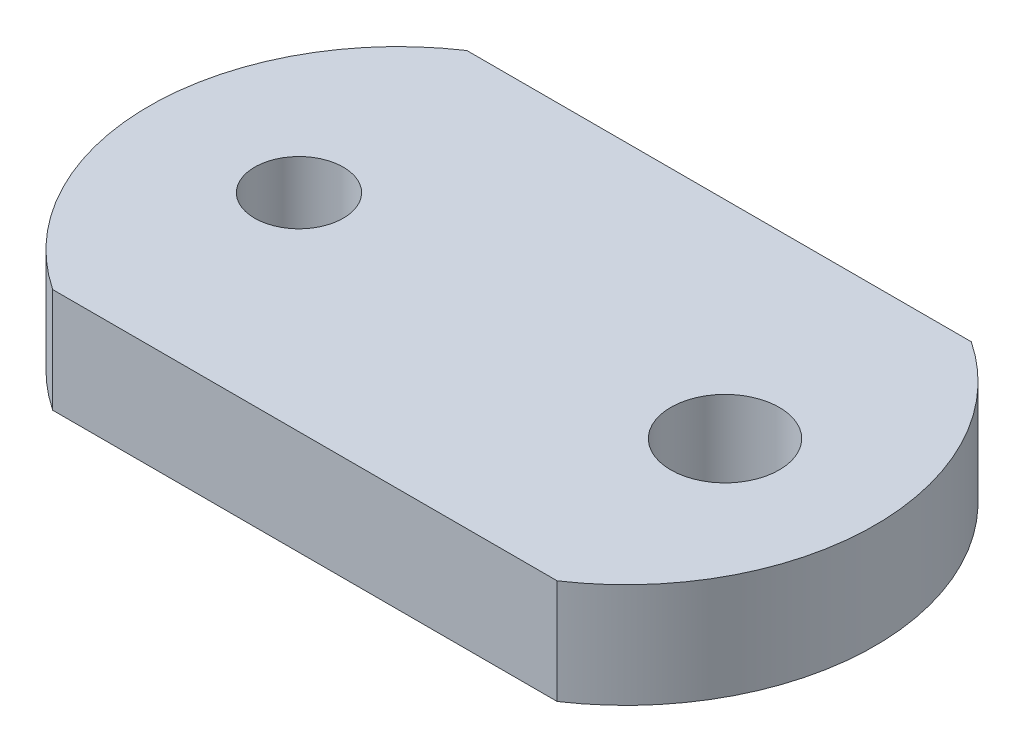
SolidWorks part; units mm, degrees
ref_plane "Front Plane" through (0, 0, 0) normal (0, 0, 1) x (1, 0, 0)
ref_plane "Top Plane" through (0, 0, 0) normal (0, 1, 0) x (1, 0, 0)
ref_plane "Right Plane" through (0, 0, 0) normal (1, 0, 0) x (0, 0, -1)
sketch "Sketch1" plane through (0, 0, 0) normal (0, 1, 0) x (1, 0, 0)
  line L1 (-11.2776, -9.2583) -> (11.2776, -9.2583)
  line L2 (-11.2776, -9.2583) -> (-11.2776, 9.2583) construction
  line L3 (-11.2776, 9.2583) -> (11.2776, 9.2583)
  line L4 (11.2776, -9.2583) -> (11.2776, 9.2583) construction
  line L5 (-11.2776, -9.2583) -> (11.2776, 9.2583) construction
  line L6 (-11.2776, 9.2583) -> (11.2776, -9.2583) construction
  arc A0 (-11.2776, 9.2583) -> (-11.2776, -9.2583) centre (-5.1012, 0) ccw
  arc A1 (11.2776, 9.2583) -> (11.2776, -9.2583) centre (5.1012, 0) cw
  point P0 (0, 0)
  dimension "D3" = 32.4612
  dimension "D1" = 18.5166
  dimension "D2" = 22.5552
extrude "Boss-Extrude1" add sketch "Sketch1" along normal mid plane 4.6736
sketch "Sketch3" plane through (0, 2.3368, 0) normal (0, 1, 0) x (1, 0, 0)
  line L0 (-9.525, 0) -> (0, 0) construction
  line L1 (0, 0) -> (9.525, 0) construction
  circle A0 centre (-9.525, 0) radius 1.9812
  circle A1 centre (9.525, 0) radius 2.4257
  dimension "D2" = 3.9624
  dimension "D3" = 4.8514
  dimension "D1" = 19.05
extrude "Cut-Extrude1" cut sketch "Sketch3" against normal through all
